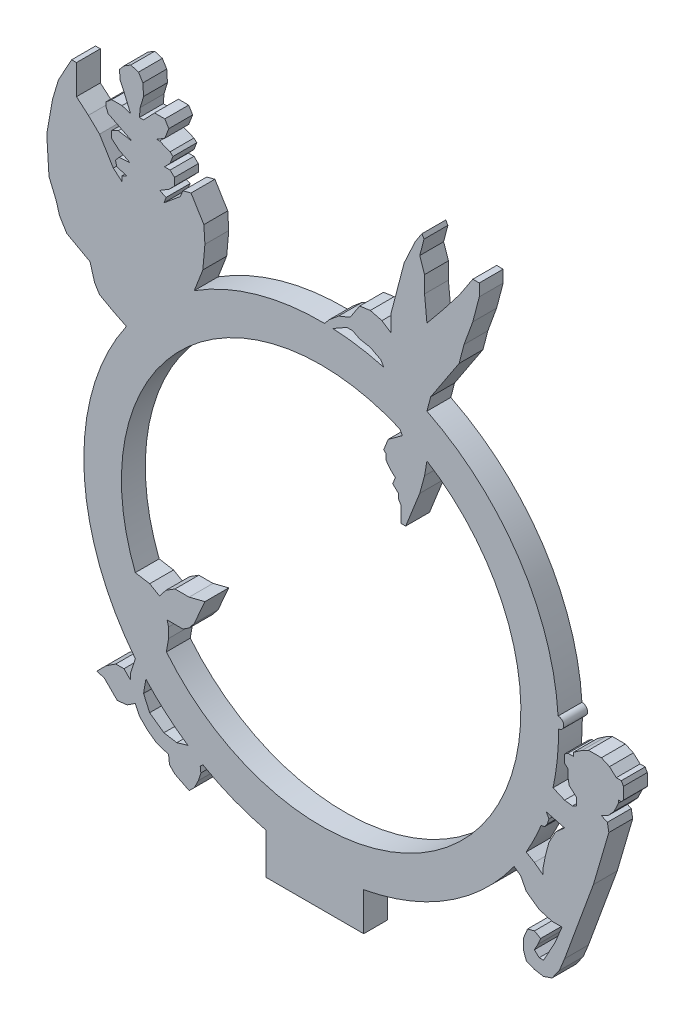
SolidWorks part; units mm, degrees
ref_plane "Plano frontal" through (0, 0, 0) normal (0, 0, 1) x (1, 0, 0)
ref_plane "Plano superior" through (0, 0, 0) normal (0, 1, 0) x (1, 0, 0)
ref_plane "Plano direito" through (0, 0, 0) normal (1, 0, 0) x (0, 0, -1)
sketch "Esboço1" plane through (0, 0, 0) normal (0, 0, 1) x (1, 0, 0)
  line L0 (141.3333, 584) -> (706.6667, 584) construction
  line L1 (54.6488, 137.5711) -> (58.2575, 136.9648)
  line L2 (58.2575, 136.9648) -> (60.739, 135.5239)
  line L3 (60.739, 135.5239) -> (62.34, 137.5711)
  line L4 (62.34, 137.5711) -> (64.6214, 139.0061)
  line L5 (64.6214, 139.0061) -> (68.1836, 139.0061)
  line L6 (68.1836, 139.0061) -> (72.146, 140.0067)
  line L7 (72.146, 140.0067) -> (70.8066, 136.9648)
  line L8 (70.8066, 136.9648) -> (69.4672, 133.9229)
  line L9 (69.4672, 133.9229) -> (68.1836, 132.2816)
  line L10 (68.1836, 132.2816) -> (66.5898, 131.2791)
  line L11 (66.5898, 131.2791) -> (62.6602, 131.2791)
  line L12 (62.6602, 131.2791) -> (63.0025, 129.9237)
  line L13 (63.0025, 129.9237) -> (63.0025, 127.4109)
  line L14 (63.0025, 127.4109) -> (62.4662, 124.2191)
  line L15 (57.3045, 115.7358) -> (56.7268, 112.2975)
  line L16 (56.7268, 112.2975) -> (58.2575, 108.8771)
  line L17 (58.2575, 108.8771) -> (61.837, 106.3086)
  line L18 (61.837, 106.3086) -> (65.0777, 105.7641)
  line L19 (65.0777, 105.7641) -> (67.8765, 106.5842)
  line L20 (54.6488, 118.8537) -> (53.4309, 114.9949)
  line L21 (53.4309, 114.9949) -> (53.4309, 113.5939)
  line L22 (53.4309, 113.5939) -> (51.7963, 115.2284)
  line L23 (51.7963, 115.2284) -> (49.7415, 115.2284)
  line L24 (49.7415, 115.2284) -> (47.2664, 113.5939)
  line L25 (47.2664, 113.5939) -> (44.978, 111.3056)
  line L26 (44.978, 111.3056) -> (46.8757, 110.7067)
  line L27 (46.8757, 110.7067) -> (48.7052, 108.8771)
  line L28 (48.7052, 108.8771) -> (50.1106, 107.4717)
  line L29 (50.1106, 107.4717) -> (52.6136, 107.7563)
  line L30 (52.6136, 107.7563) -> (54.6488, 109.1003)
  line L31 (54.6488, 109.1003) -> (55.6725, 106.869)
  line L32 (55.6725, 106.869) -> (57.7507, 104.7908)
  line L33 (57.7507, 104.7908) -> (60.0157, 103.133)
  line L34 (60.0157, 103.133) -> (63.0025, 102.1903)
  line L35 (63.0025, 102.1903) -> (63.2469, 100.0411)
  line L36 (63.2469, 100.0411) -> (64.6214, 98.6666)
  line L37 (64.6214, 98.6666) -> (66.9741, 97.4822)
  line L38 (66.9741, 97.4822) -> (68.1836, 96.8732)
  line L39 (68.1836, 96.8732) -> (69.4672, 98.1569)
  line L40 (69.4672, 98.1569) -> (70.5074, 100.223)
  line L41 (70.5074, 100.223) -> (71.1283, 102.1903)
  line L42 (71.1283, 102.1903) -> (70.9699, 103.5828)
  line L43 (70.9699, 103.5828) -> (71.6259, 104.2388)
  line L44 (87.5511, 87.6576) -> (87.5511, 97.9174)
  line L45 (112.0733, 87.6576) -> (112.0733, 97.261)
  line L46 (87.5511, 87.6576) -> (112.0733, 87.6576)
  line L47 (71.6259, 211.9669) -> (69.4672, 206.3861)
  line L48 (71.6259, 211.9669) -> (72.146, 217.8057)
  line L49 (72.146, 217.8057) -> (71.886, 221.9643)
  line L50 (71.886, 221.9643) -> (68.6589, 227.2402)
  line L51 (68.6589, 227.2402) -> (66.5898, 226.6816)
  line L52 (66.5898, 226.6816) -> (65.9944, 225.1422)
  line L53 (65.9944, 225.1422) -> (63.0025, 222.6471)
  line L54 (63.0025, 222.6471) -> (61.837, 221.6751)
  line L55 (61.837, 221.6751) -> (62.4197, 223.1817)
  line L56 (62.4197, 223.1817) -> (60.739, 223.8318)
  line L57 (60.739, 223.8318) -> (63.2469, 225.3658)
  line L58 (63.2469, 225.3658) -> (64.4984, 226.6816)
  line L59 (64.4984, 226.6816) -> (64.4984, 228.5556)
  line L60 (64.4984, 228.5556) -> (63.3967, 229.6036)
  line L61 (63.3967, 229.6036) -> (61.993, 229.6036)
  line L62 (61.993, 229.6036) -> (63.3967, 231.0794)
  line L63 (63.3967, 231.0794) -> (64.1039, 232.9077)
  line L64 (64.1039, 232.9077) -> (63.3967, 233.5803)
  line L65 (63.3967, 233.5803) -> (60.739, 234.6083)
  line L66 (60.739, 234.6083) -> (60.0157, 234.6083)
  line L67 (60.0157, 234.6083) -> (62.0679, 235.8636)
  line L68 (62.0679, 235.8636) -> (63.068, 238.4492)
  line L69 (63.068, 238.4492) -> (62.0679, 240.0843)
  line L70 (62.0679, 240.0843) -> (59.4862, 240.0843)
  line L71 (59.4862, 240.0843) -> (58.2575, 238.7925)
  line L72 (58.2575, 238.7925) -> (56.7268, 237.1832)
  line L73 (56.7268, 237.1832) -> (55.6725, 237.1832)
  line L74 (55.6725, 237.1832) -> (55.8734, 239.4384)
  line L75 (55.8734, 239.4384) -> (56.7268, 242.2903)
  line L76 (56.7268, 242.2903) -> (56.5473, 245.1606)
  line L77 (56.5473, 245.1606) -> (55.4493, 246.9557)
  line L78 (55.4493, 246.9557) -> (53.52, 247.5331)
  line L79 (53.52, 247.5331) -> (51.7963, 246.4787)
  line L80 (51.7963, 246.4787) -> (50.6763, 245.1606)
  line L81 (50.6763, 245.1606) -> (50.8183, 242.8897)
  line L82 (50.8183, 242.8897) -> (51.7963, 240.8644)
  line L83 (51.7963, 240.8644) -> (52.8623, 238.3108)
  line L84 (52.8623, 238.3108) -> (53.4309, 236.9488)
  line L85 (53.4309, 236.9488) -> (51.3073, 237.5843)
  line L86 (51.3073, 237.5843) -> (48.7052, 237.5843)
  line L87 (48.7052, 237.5843) -> (47.2664, 236.3844)
  line L88 (47.2664, 236.3844) -> (47.3382, 235.236)
  line L89 (47.3382, 235.236) -> (47.8148, 234.0943)
  line L90 (47.8148, 234.0943) -> (50.8183, 232.5966)
  line L91 (50.8183, 232.5966) -> (53.1466, 231.4357)
  line L92 (53.1466, 231.4357) -> (53.8611, 231.0794)
  line L93 (53.8611, 231.0794) -> (50.3446, 231.6465)
  line L94 (50.3446, 231.6465) -> (48.7052, 230.8549)
  line L95 (48.7052, 230.8549) -> (48.7052, 229.1246)
  line L96 (48.7052, 229.1246) -> (50.6061, 227.5094)
  line L97 (50.6061, 227.5094) -> (53.3112, 226.1605)
  line L98 (53.3112, 226.1605) -> (50.6061, 225.9914)
  line L99 (50.6061, 225.9914) -> (49.6556, 224.8728)
  line L100 (49.6556, 224.8728) -> (50.0062, 223.6394)
  line L101 (50.0062, 223.6394) -> (52.539, 222.8814)
  line L102 (52.539, 222.8814) -> (51.2726, 222.2699)
  line L103 (51.2726, 222.2699) -> (51.2726, 221.0538)
  line L104 (51.2726, 221.0538) -> (49.1217, 222.8814)
  line L105 (49.1217, 222.8814) -> (47.8148, 225.018)
  line L106 (47.8148, 225.018) -> (45.6509, 228.5556)
  line L107 (45.6509, 228.5556) -> (42.8525, 231.2507)
  line L108 (42.8525, 231.2507) -> (39.854, 233.7985)
  line L109 (39.854, 233.7985) -> (39.854, 241.2351)
  line L110 (39.854, 241.2351) -> (38.6417, 241.2351)
  line L111 (38.6417, 241.2351) -> (35.3344, 235.236)
  line L112 (35.3344, 235.236) -> (33.8419, 230.2486)
  line L113 (33.8419, 230.2486) -> (32.3829, 221.9676)
  line L114 (32.3829, 221.9676) -> (32.9446, 212.9865)
  line L115 (32.9446, 212.9865) -> (34.8234, 208.4858)
  line L116 (34.8234, 208.4858) -> (35.5848, 205.8072)
  line L117 (35.5848, 205.8072) -> (37.4187, 202.8091)
  line L118 (37.4187, 202.8091) -> (40.7511, 200.9719)
  line L119 (40.7511, 200.9719) -> (43.2815, 199.577)
  line L120 (43.2815, 199.577) -> (44.394, 195.6634)
  line L121 (44.394, 195.6634) -> (45.6509, 193.6085)
  line L122 (45.6509, 193.6085) -> (49.1217, 191.6951)
  line L123 (49.1217, 191.6951) -> (52.4046, 190.0581)
  line L124 (128.9083, 212.9865) -> (127.9676, 209.3804)
  line L125 (128.9083, 212.9865) -> (132.0846, 217.8057)
  line L126 (132.0846, 217.8057) -> (136.0564, 223.8318)
  line L127 (136.0564, 223.8318) -> (137.2887, 228.5556)
  line L128 (137.2887, 228.5556) -> (139.4962, 234.6083)
  line L129 (139.4962, 234.6083) -> (141.1281, 240.8644)
  line L130 (141.1281, 240.8644) -> (141.1281, 243.8916)
  line L131 (141.1281, 243.8916) -> (139.4962, 243.8916)
  line L132 (139.4962, 243.8916) -> (136.1541, 238.821)
  line L133 (136.1541, 238.821) -> (132.0846, 233.5803)
  line L134 (132.0846, 233.5803) -> (127.9676, 228.5556)
  line L135 (127.9676, 228.5556) -> (127.3666, 234.6083)
  line L136 (127.3666, 234.6083) -> (127.3666, 238.821)
  line L137 (127.3666, 238.821) -> (126.1643, 242.378)
  line L138 (126.1643, 242.378) -> (127.234, 246.4787)
  line L139 (127.234, 246.4787) -> (126.6991, 247.3911)
  line L140 (126.6991, 247.3911) -> (125.0377, 244.8618)
  line L141 (125.0377, 244.8618) -> (122.2449, 238.821)
  line L142 (122.2449, 238.821) -> (121.146, 234.6083)
  line L143 (121.146, 234.6083) -> (119.9375, 229.9756)
  line L144 (119.9375, 229.9756) -> (118.8982, 225.9914)
  line L145 (118.8982, 225.9914) -> (118.8982, 221.9643)
  line L146 (118.8982, 221.9643) -> (116.646, 223.4437)
  line L147 (116.646, 223.4437) -> (113.7283, 224.2048)
  line L148 (113.7283, 224.2048) -> (111.0531, 223.8242)
  line L149 (111.0531, 223.8242) -> (109.8315, 221.9643)
  line L150 (109.8315, 221.9643) -> (108.6601, 220.181)
  line L151 (108.6601, 220.181) -> (105.7395, 218.9828)
  line L152 (105.7395, 218.9828) -> (103.37, 216.9893)
  line L153 (103.37, 216.9893) -> (102.2409, 215.6275)
  line L154 (106.2285, 216.6508) -> (104.3196, 215.5611)
  line L155 (106.2285, 216.6508) -> (107.8289, 217.5645)
  line L156 (107.8289, 217.5645) -> (109.3127, 217.5645)
  line L157 (109.3127, 217.5645) -> (111.0531, 216.6508)
  line L158 (111.0531, 216.6508) -> (112.7354, 216.3499)
  line L159 (112.7354, 216.3499) -> (113.7283, 216.1723)
  line L160 (113.7283, 216.1723) -> (116.3901, 214.7751)
  line L161 (116.3901, 214.7751) -> (117.1048, 213.5231)
  line L162 (121.146, 202.1237) -> (121.8035, 200.9719)
  line L163 (121.8035, 200.9719) -> (118.2345, 198.3899)
  line L164 (118.2345, 198.3899) -> (117.1048, 195.5471)
  line L165 (117.1048, 195.5471) -> (117.6696, 195.0136)
  line L166 (117.6696, 195.0136) -> (117.6696, 193.6085)
  line L167 (117.6696, 193.6085) -> (118.7142, 192.1646)
  line L168 (118.7142, 192.1646) -> (120.019, 190.9322)
  line L169 (120.019, 190.9322) -> (119.3666, 189.2905)
  line L170 (119.3666, 189.2905) -> (120.7805, 187.9551)
  line L171 (120.7805, 187.9551) -> (120.7805, 186.7958)
  line L172 (120.7805, 186.7958) -> (121.4747, 185.5797)
  line L173 (121.4747, 185.5797) -> (121.4747, 183.2284)
  line L174 (121.4747, 183.2284) -> (121.4747, 181.6994)
  line L175 (121.4747, 181.6994) -> (122.6301, 181.6994)
  line L176 (122.6301, 181.6994) -> (123.8448, 184.7563)
  line L177 (123.8448, 184.7563) -> (126.1643, 190.593)
  line L178 (126.1643, 190.593) -> (127.3666, 195.0136)
  line L179 (127.3666, 195.0136) -> (127.9676, 198.5602)
  line L180 (149.8871, 121.2213) -> (151.5341, 120.0418)
  line L181 (151.5341, 120.0418) -> (152.953, 117.315)
  line L182 (152.953, 117.315) -> (156.1927, 114.9949)
  line L183 (156.1927, 114.9949) -> (159.4274, 114.0487)
  line L184 (159.4274, 114.0487) -> (161.9355, 114.0487)
  line L185 (161.9355, 114.0487) -> (160.1273, 109.6741)
  line L186 (160.1273, 109.6741) -> (158.2761, 106.3086)
  line L187 (158.2761, 106.3086) -> (157.2838, 104.5045)
  line L188 (157.2838, 104.5045) -> (156.1927, 104.5045)
  line L189 (156.1927, 104.5045) -> (154.9877, 105.6357)
  line L190 (154.9877, 105.6357) -> (155.9008, 107.2958)
  line L191 (155.9008, 107.2958) -> (156.5544, 108.8771)
  line L192 (156.5544, 108.8771) -> (154.9877, 109.739)
  line L193 (154.9877, 109.739) -> (153.2722, 109.308)
  line L194 (153.2722, 109.308) -> (152.2435, 106.8192)
  line L195 (152.2435, 106.8192) -> (152.2435, 104.2388)
  line L196 (152.2435, 104.2388) -> (152.953, 102.1903)
  line L197 (152.953, 102.1903) -> (154.9877, 101.3493)
  line L198 (154.9877, 101.3493) -> (157.2838, 100.9602)
  line L199 (157.2838, 100.9602) -> (159.4274, 101.7026)
  line L200 (159.4274, 101.7026) -> (161.2436, 104.2388)
  line L201 (161.2436, 104.2388) -> (162.5799, 107.4717)
  line L202 (162.5799, 107.4717) -> (166.1846, 117.315)
  line L203 (166.1846, 117.315) -> (169.8157, 127.2303)
  line L204 (169.8157, 127.2303) -> (173.7022, 140.5162)
  line L205 (173.7022, 140.5162) -> (173.3277, 142.5581)
  line L206 (173.3277, 142.5581) -> (171.8397, 143.243)
  line L207 (171.8397, 143.243) -> (173.5149, 144.1146)
  line L208 (173.5149, 144.1146) -> (175.0398, 145.7956)
  line L209 (175.0398, 145.7956) -> (176.1007, 148.1006)
  line L210 (176.1007, 148.1006) -> (176.1007, 148.8152)
  line L211 (176.1007, 148.8152) -> (176.8453, 148.8152)
  line L212 (176.8453, 148.8152) -> (177.3616, 149.3843)
  line L213 (177.3616, 149.3843) -> (177.3616, 152.3951)
  line L214 (177.3616, 152.3951) -> (176.8453, 153.3874)
  line L215 (176.8453, 153.3874) -> (175.5702, 153.3874)
  line L216 (175.5702, 153.3874) -> (173.8636, 154.9356)
  line L217 (173.8636, 154.9356) -> (171.8397, 155.8671)
  line L218 (171.8397, 155.8671) -> (168.5875, 155.8671)
  line L219 (168.5875, 155.8671) -> (166.9845, 155.0331)
  line L220 (166.9845, 155.0331) -> (164.8083, 153.5449)
  line L221 (164.8083, 153.5449) -> (164.8083, 152.6425)
  line L222 (164.8083, 152.6425) -> (163.4356, 152.6425)
  line L223 (163.4356, 152.6425) -> (162.5799, 152.0574)
  line L224 (162.5799, 152.0574) -> (162.5799, 150.0281)
  line L225 (162.5799, 150.0281) -> (163.4356, 149.2519)
  line L226 (163.4356, 149.2519) -> (163.4356, 147.3625)
  line L227 (163.4356, 147.3625) -> (163.7229, 145.7956)
  line L228 (163.7229, 145.7956) -> (164.9953, 144.6414)
  line L229 (164.9953, 144.6414) -> (165.576, 144.1146)
  line L230 (165.576, 144.1146) -> (165.576, 142.2575)
  line L231 (165.576, 142.2575) -> (164.5516, 141.7245)
  line L232 (164.5516, 141.7245) -> (162.5799, 141.991)
  line L233 (162.5799, 141.991) -> (159.6729, 143.243)
  line L234 (158.0028, 137.1553) -> (158.64, 135.9396)
  line L235 (158.64, 135.9396) -> (158.2271, 134.6171)
  line L236 (158.2271, 134.6171) -> (157.5113, 133.6822)
  line L237 (157.5113, 133.6822) -> (156.684, 133.5724)
  line L238 (158.0028, 137.1553) -> (162.5799, 135.9396)
  line L239 (162.5799, 135.9396) -> (160.2914, 133.9229)
  line L240 (160.2914, 133.9229) -> (158.64, 130.8434)
  line L241 (158.64, 130.8434) -> (157.7922, 127.6515)
  line L242 (157.7922, 127.6515) -> (157.0977, 124.2191)
  line L243 (157.0977, 124.2191) -> (157.0977, 123.0793)
  line L244 (157.0977, 123.0793) -> (154.9877, 124.646)
  line L245 (154.9877, 124.646) -> (152.8981, 125.8666)
  arc A0 (62.4662, 124.2191) -> (127.9676, 198.5602) centre (101.3748, 155.9639) ccw
  arc A1 (57.3045, 115.7358) -> (67.8765, 106.5842) centre (101.3748, 155.9639) ccw
  arc A2 (161.0392, 156.7719) -> (160.9403, 159.4921) centre (161.0053, 158.1326) ccw
  arc A3 (71.6259, 104.2388) -> (87.5511, 97.9174) centre (101.3748, 155.9639) ccw
  arc A4 (112.0733, 97.261) -> (149.8871, 121.2213) centre (101.3748, 155.9639) ccw
  arc A5 (152.8981, 125.8666) -> (156.684, 133.5724) centre (101.3748, 155.9639) ccw
  arc A6 (159.6729, 143.243) -> (161.0392, 156.7719) centre (101.3748, 155.9639) ccw
  arc A7 (160.9403, 159.4921) -> (127.9676, 209.3804) centre (101.3748, 155.9639) ccw
  arc A8 (117.1048, 213.5231) -> (104.3196, 215.5611) centre (101.3748, 155.9639) ccw
  arc A9 (121.146, 202.1237) -> (54.6488, 137.5711) centre (101.3748, 155.9639) ccw
  arc A10 (52.4046, 190.0581) -> (54.6488, 118.8537) centre (101.3748, 155.9639) ccw
  arc A11 (102.2409, 215.6275) -> (69.4672, 206.3861) centre (101.3748, 155.9639) ccw
extrude "Ressalto-extrusão1" add sketch "Esboço1" along normal blind 6
